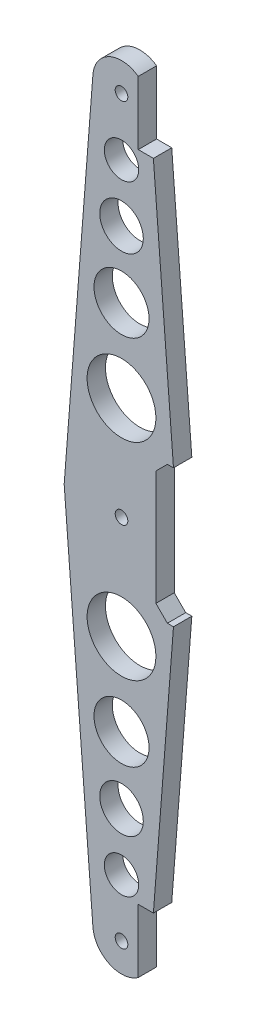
SolidWorks part; units mm, degrees
ref_plane "Front Plane" through (0, 0, 0) normal (0, 0, 1) x (1, 0, 0)
ref_plane "Top Plane" through (0, 0, 0) normal (0, 1, 0) x (1, 0, 0)
ref_plane "Right Plane" through (0, 0, 0) normal (1, 0, 0) x (0, 0, -1)
sketch "Sketch1" plane through (0, 0, 0) normal (0, 0, 1) x (1, 0, 0)
  line L0 (5, 0) -> (-5, 0) construction
  line L1 (-5, 0) -> (-2.4925, 32.1941)
  line L2 (2.4925, 32.1941) -> (5, 0)
  line L3 (2.4925, -32.1941) -> (5, 0)
  line L4 (-5, 0) -> (-2.4925, -32.1941)
  arc A0 (-2.4925, 32.1941) -> (2.4925, 32.1941) centre (0, 32) cw
  arc A1 (-2.4925, -32.1941) -> (2.4925, -32.1941) centre (0, -32) ccw
  point P6 (0, 0)
  dimension "D1" = 2.5
  dimension "D2" = 32
  dimension "D3" = 10
extrude "Boss-Extrude1" add sketch "Sketch1" along normal blind 1.6
sketch "Sketch2" plane through (0, 0, 1.6) normal (0, 0, 1) x (1, 0, 0)
  circle A0 centre (0, 0) radius 0.55
  dimension "D1" = 1.1
extrude "Cut-Extrude1" cut sketch "Sketch2" against normal through all
sketch "Sketch3" plane through (0, 0, 1.6) normal (0, 0, 1) x (1, 0, 0)
  circle A0 centre (0, 9) radius 3
  circle A1 centre (0, 16.2) radius 2.4
  circle A2 centre (0, 22) radius 1.9
  circle A3 centre (0, 27) radius 1.5
  circle A4 centre (0, 32) radius 0.55
  arc A5 (2.4925, 32.1941) -> (-2.4925, 32.1941) centre (0, 32) ccw construction
  arc A6 (2.4925, 32.1941) -> (-2.4925, 32.1941) centre (0, 32) ccw construction
  point P10 (0, 34.5)
  point P15 (0, 34.5)
  point P19 (0, 34.5)
  point P20 (0, 34.5)
  point P21 (0, 34.5)
  dimension "D1" = 1.1
  dimension "D2" = 3
  dimension "D3" = 3.8
  dimension "D4" = 4.8
  dimension "D5" = 6
  dimension "D6" = 25.5
  dimension "D7" = 18.3
  dimension "D8" = 12.5
  dimension "D9" = 7.5
  dimension "D10" = 2.5
extrude "Cut-Extrude2" cut sketch "Sketch3" against normal through all
sketch "Sketch6" plane through (0, 0, 1.6) normal (0, 0, 1) x (1, 0, 0)
  line L1 (4.5396, 34.5) -> (1.46, 34.5)
  line L2 (4.5396, 34.5) -> (4.5396, 28.5)
  line L3 (4.5396, 28.5) -> (1.46, 28.5)
  line L4 (1.46, 34.5) -> (1.46, 28.5)
  circle A0 centre (0, 32) radius 0.55 construction
  arc A5 (2.4925, 32.1941) -> (-2.4925, 32.1941) centre (0, 32) ccw construction
  dimension "D1" = 6
  dimension "D2" = 1.46
  dimension "D3" = 3.0796
extrude "Cut-Extrude4" cut sketch "Sketch6" against normal through all
mirror "Mirror1" about plane through (0, 0, 0) normal (0, 1, 0) of "Cut-Extrude4", "Cut-Extrude2"
sketch "Sketch5" plane through (0, 0, 1.6) normal (0, 0, 1) x (1, 0, 0)
  line L0 (4, 6) -> (3, 5)
  line L1 (10, 6) -> (4, 6)
  line L2 (10, 6) -> (10, -6)
  line L3 (10, -6) -> (4, -6)
  line L4 (3, 5) -> (3, -5)
  line L5 (4, -6) -> (3, -5)
  point P1 (3, -6)
  point P3 (3, 6)
  point P4 (10, 0)
  dimension "D1" = 12
  dimension "D2" = 7
  dimension "D3" = 2
extrude "Cut-Extrude3" cut sketch "Sketch5" against normal through all
